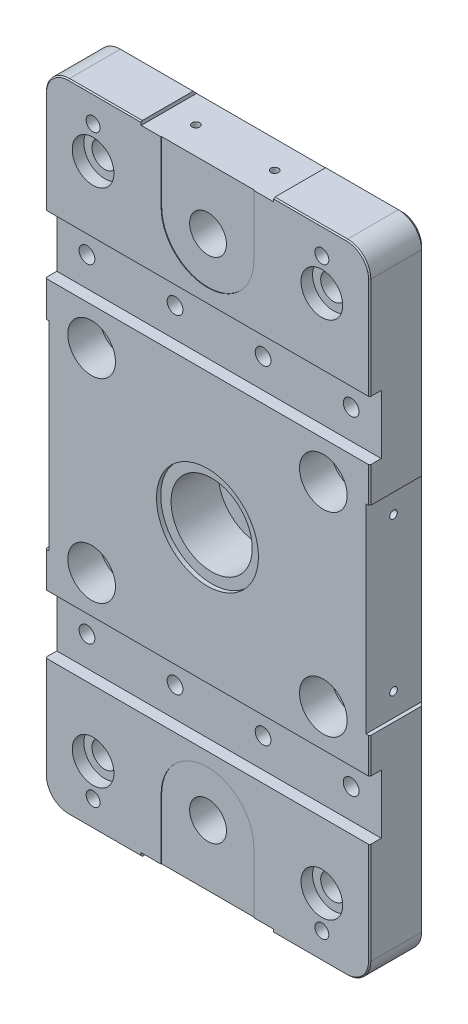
SolidWorks part; units mm, degrees
ref_plane "Front Plane" through (0, 0, 0) normal (0, 0, 1) x (1, 0, 0)
ref_plane "Top Plane" through (0, 0, 0) normal (0, 1, 0) x (1, 0, 0)
ref_plane "Right Plane" through (0, 0, 0) normal (1, 0, 0) x (0, 0, -1)
sketch "Sketch1" plane through (0, 0, 0) normal (0, 0, 1) x (1, 0, 0)
  line L1 (-60, 137.5) -> (60, 137.5)
  line L2 (-70, 127.5) -> (-70, -127.5)
  line L3 (-60, -137.5) -> (60, -137.5)
  line L4 (70, 127.5) -> (70, -127.5)
  line L5 (-70, 137.5) -> (70, -137.5) construction
  line L6 (-70, -137.5) -> (70, 137.5) construction
  arc A0 (-60, 137.5) -> (-70, 127.5) centre (-60, 127.5) ccw
  arc A1 (70, 127.5) -> (60, 137.5) centre (60, 127.5) ccw
  arc A2 (60, -137.5) -> (70, -127.5) centre (60, -127.5) ccw
  arc A3 (-70, -127.5) -> (-60, -137.5) centre (-60, -127.5) ccw
  point P0 (0, 0)
  dimension "D3" = 10
  dimension "D1" = 140
  dimension "D2" = 275
extrude "Extrude1" add sketch "Sketch1" along normal blind 23.9
sketch "Sketch6" plane through (0, 0, 0) normal (0, 0, -1) x (-1, 0, 0)
  line L0 (-49.43, 74.93) -> (-62.43, 61.93)
  line L1 (-49.43, 74.93) -> (49.43, 74.93)
  line L2 (-62.43, 61.93) -> (-62.43, -61.93)
  line L3 (-49.43, -74.93) -> (49.43, -74.93)
  line L4 (62.43, 61.93) -> (62.43, -61.93)
  line L5 (-62.43, 74.93) -> (62.43, -74.93) construction
  line L6 (-62.43, -74.93) -> (62.43, 74.93) construction
  line L7 (49.43, 74.93) -> (62.43, 61.93)
  line L8 (62.43, -61.93) -> (49.43, -74.93)
  line L9 (-62.43, -61.93) -> (-49.43, -74.93)
  point P0 (0, 0)
  dimension "D1" = 62.43
  dimension "D2" = 74.93
  dimension "D3" = 74.93
extrude "Extrude5" add sketch "Sketch6" along normal blind 6
sketch "Sketch2" plane through (0, 0, 23.9) normal (0, 0, 1) x (1, 0, 0)
  circle A0 centre (0, 0) radius 22
  dimension "D1" = 44
extrude "Extrude2" cut sketch "Sketch2" against normal blind 1.8
sketch "Sketch3" plane through (0, 0, 23.9) normal (0, 0, 1) x (1, 0, 0)
  line L0 (-85.9067, 0) -> (80.4153, 0) construction
  line L1 (-70, 127.5) -> (-70, -127.5) construction
  line L2 (-70, 83.7) -> (-70, 58.2)
  line L3 (70, -127.5) -> (70, 127.5) construction
  line L4 (70, -83.7) -> (70, -58.2)
  line L5 (-70, -58.2) -> (70, -58.2)
  line L6 (-70, 58.2) -> (70, 58.2)
  line L7 (-70, 83.7) -> (70, 83.7)
  line L8 (-70, -83.7) -> (70, -83.7)
  line L9 (-85.9067, 83.7) -> (80.4153, 83.7) construction
  line L10 (-85.9067, -83.7) -> (80.4153, -83.7) construction
  line L11 (-85.9067, 58.2) -> (80.4153, 58.2) construction
  line L12 (-85.9067, -58.2) -> (80.4153, -58.2) construction
  line L13 (70, 58.2) -> (70, 83.7)
  line L14 (-70, -58.2) -> (-70, -83.7)
  dimension "D1" = 58.2
  dimension "D2" = 58.2
  dimension "D3" = 25.5
  dimension "D4" = 25.5
extrude "Extrude3" cut sketch "Sketch3" against normal blind 5
sketch "Sketch5" plane through (0, 0, 23.9) normal (0, 0, 1) x (1, 0, 0)
  circle A0 centre (0, 0) radius 17.5125
  dimension "D1" = 35.025
extrude "Extrude4" cut sketch "Sketch5" against normal blind 22.2
sketch "Sketch7" plane through (0, 0, 23.9) normal (0, 0, 1) x (1, 0, 0)
  line L0 (0, 0) -> (78.6902, 0) construction
  circle A0 centre (0, 109.6) radius 7.95
  circle A1 centre (0, 0) radius 17.5125 construction
  circle A2 centre (0, -109.6) radius 7.95
  dimension "D1" = 15.9
  dimension "D2" = 109.6
extrude "Extrude6" cut sketch "Sketch7" against normal blind 22
sketch "Sketch9" plane through (70, 0, 0) normal (1, 0, 0) x (0, 0, -1)
  line L0 (0, 0) -> (-23.9, 0) construction
  line L2 (0, -127.5) -> (0, 127.5) construction
  line L3 (-23.9, -58.2) -> (-23.9, 58.2) construction
  line L4 (0, 43) -> (-23.9, 43)
  line L5 (0, -43) -> (-23.9, -43)
  line L6 (0, -43) -> (0, 43)
  line L7 (-23.9, -43) -> (-23.9, 43)
  dimension "D1" = 43
  dimension "D2" = 43
extrude "Cut-Extrude1" cut sketch "Sketch9" against normal blind 1.6
mirror "Mirror1" about plane through (0, 0, 0) normal (1, 0, 0) of "Cut-Extrude1"
sketch "Sketch10" plane through (0, 137.5, 0) normal (0, 1, 0) x (1, 0, 0)
  line L4 (-28.6, -26) -> (28.6, -26)
  line L11 (-28.6, -26) -> (-28.6, 2)
  line L12 (-28.6, 2) -> (28.6, 2)
  line L13 (28.6, -26) -> (28.6, 2)
  dimension "D1" = 28.6
  dimension "D2" = 28.6
  dimension "D3" = 2
  dimension "D4" = 28
extrude "Cut-Extrude2" cut sketch "Sketch10" against normal blind 1.6
mirror "Mirror2" about plane through (0, 0, 0) normal (0, 1, 0) of "Cut-Extrude2"
sketch "Sketch13" plane through (0, -135.9, 0) normal (0, -1, 0) x (1, 0, 0)
  line L0 (28.6, 23.9) -> (-28.6, 23.9) construction
  circle A0 centre (-17, 11.9) radius 1.65
  circle A1 centre (17, 11.9) radius 1.65
  dimension "D1" = 3.3
  dimension "D2" = 17
  dimension "D3" = 17
  dimension "D4" = 12
extrude "Cut-Extrude5" cut sketch "Sketch13" against normal blind 8
sketch "Sketch14" plane through (0, -127.9, 0) normal (0, -1, 0) x (1, 0, 0)
  circle A1 centre (-17, 11.9) radius 1.65
  circle A2 centre (-17, 11.9) radius 1.65
  circle A3 centre (17, 11.9) radius 1.65
  circle A4 centre (17, 11.9) radius 1.65
  dimension "D1" = 0
  dimension "D2" = 0
extrude "Cut-Extrude6" cut sketch "Sketch14" against normal through all draft 60
mirror "Mirror4" about plane through (0, 0, 0) normal (0, 1, 0) of "Cut-Extrude5", "Cut-Extrude6"
sketch "Sketch16" plane through (-68.4, 0, 0) normal (-1, 0, 0) x (0, 0, 1)
  line L0 (0, 127.5) -> (0, 43) construction
  line L1 (0, -43) -> (0, 43) construction
  line L2 (0, 0) -> (246.7651, 0) construction
  circle A0 centre (12, 33) radius 1.65
  circle A1 centre (12, -33) radius 1.65
  point P6 (0, 0)
  dimension "D1" = 3.3
  dimension "D2" = 12
  dimension "D3" = 33
extrude "Cut-Extrude8" cut sketch "Sketch16" against normal blind 8
sketch "Sketch17" plane through (-60.4, 0, 0) normal (-1, 0, 0) x (0, 0, 1)
  circle A1 centre (12, 33) radius 1.65
  circle A2 centre (12, 33) radius 1.65
  circle A3 centre (12, -33) radius 1.65
  circle A4 centre (12, -33) radius 1.65
  dimension "D1" = 0
  dimension "D2" = 0
extrude "Cut-Extrude9" cut sketch "Sketch17" against normal through all draft 60
mirror "Mirror5" about plane through (0, 0, 0) normal (1, 0, 0) of "Cut-Extrude9", "Cut-Extrude8"
sketch "Sketch20" plane through (0, 0, 0) normal (0, 0, -1) x (-1, 0, 0)
  line L0 (-49.36, -112.1) -> (59.1067, -112.1) construction
  line L1 (-49.36, 112.1) -> (55.5643, 112.1) construction
  circle A1 centre (-49.36, -112.1) radius 8.5
  circle A3 centre (49.36, -112.1) radius 8.5
  circle A5 centre (-49.36, 112.1) radius 8.5
  circle A7 centre (49.36, 112.1) radius 8.5
  dimension "D1" = 17
  dimension "D6" = 17
  dimension "D8" = 17
  dimension "D10" = 17
  dimension "D2" = 49.36
  dimension "D3" = 112.1
  dimension "D4" = 49.36
  dimension "D5" = 49.36
  dimension "D7" = 112.1
  dimension "D9" = 49.36
extrude "Cut-Extrude12" cut sketch "Sketch20" against normal blind 10.8
sketch "Sketch21" plane through (0, 0, 23.9) normal (0, 0, 1) x (1, 0, 0)
  circle A0 centre (49.36, -126.1) radius 3
  circle A1 centre (-49.36, -126.1) radius 3
  circle A2 centre (-49.36, 126.1) radius 3
  circle A3 centre (49.36, 126.1) radius 3
  dimension "D1" = 6
  dimension "D2" = 126.1
  dimension "D3" = 49.36
  dimension "D4" = 126.1
  dimension "D5" = 49.36
extrude "Cut-Extrude13" cut sketch "Sketch21" against normal blind 12
sketch "Sketch22" plane through (0, 0, 11.9) normal (0, 0, 1) x (1, 0, 0)
  circle A1 centre (49.36, -126.1) radius 3
  circle A2 centre (49.36, -126.1) radius 3
  circle A3 centre (-49.36, -126.1) radius 3
  circle A4 centre (-49.36, -126.1) radius 3
  circle A5 centre (49.36, 126.1) radius 3
  circle A6 centre (49.36, 126.1) radius 3
  circle A7 centre (-49.36, 126.1) radius 3
  circle A8 centre (-49.36, 126.1) radius 3
  dimension "D1" = 0
  dimension "D2" = 0
  dimension "D3" = 0
  dimension "D4" = 0
extrude "Cut-Extrude14" cut sketch "Sketch22" against normal through all draft 60
sketch "Sketch23" plane through (0, 0, 18.9) normal (0, 0, 1) x (1, 0, 0)
  line L0 (-57, -70.9) -> (79.5762, -70.9) construction
  line L1 (0, 0) -> (101.5861, 0) construction
  line L2 (-57, 70.9) -> (79.5762, 70.9) construction
  circle A0 centre (-57, -70.9) radius 3.4
  circle A1 centre (-19, -70.9) radius 3.4
  circle A2 centre (19, -70.9) radius 3.4
  circle A3 centre (57, -70.9) radius 3.4
  circle A4 centre (57, 70.9) radius 3.4
  circle A5 centre (19, 70.9) radius 3.4
  circle A6 centre (-19, 70.9) radius 3.4
  circle A7 centre (-57, 70.9) radius 3.4
  dimension "D1" = 6.8
  dimension "D4" = 6.8
  dimension "D7" = 6.8
  dimension "D9" = 6.8
  dimension "D2" = 57
  dimension "D3" = 70.9
  dimension "D5" = 19
  dimension "D6" = 19
  dimension "D8" = 57
extrude "Cut-Extrude15" cut sketch "Sketch23" against normal blind 12
sketch "Sketch25" plane through (0, 0, 23.9) normal (0, 0, 1) x (1, 0, 0)
  circle A0 centre (-50, 42) radius 6.75
  circle A1 centre (50, 42) radius 6.75
  circle A2 centre (50, -42) radius 6.75
  circle A3 centre (-50, -42) radius 6.75
  dimension "D1" = 13.5
  dimension "D2" = 42
  dimension "D3" = 50
  dimension "D4" = 42
  dimension "D5" = 50
extrude "Extrude8" cut sketch "Sketch25" against normal through all
sketch "Sketch26" plane through (0, 0, 23.9) normal (0, 0, 1) x (1, 0, 0)
  circle A0 centre (-50, 42) radius 10.285
  circle A1 centre (50, 42) radius 10.285
  circle A2 centre (50, -42) radius 10.285
  circle A3 centre (-50, -42) radius 10.285
  dimension "D1" = 20.57
extrude "Extrude9" cut sketch "Sketch26" against normal blind 13.72
chamfer "Chamfer1" distance 1 angle 45 8 edges at (-55.93, 68.43, -6) (-62.43, 0, -6) (-55.93, -68.43, -6) (0, -74.93, -6) (55.93, -68.43, -6) (62.43, 0, -6) (55.93, 68.43, -6) (0, 74.93, -6)
chamfer "Chamfer2" distance 1.5 angle 45 12 edges at (70, -85.25, 0) (67.0711, -134.5711, 0) (44.3, -137.5, 0) (-70, -85.25, 0) (-67.0711, -134.5711, 0) (-44.3, -137.5, 0) (-44.3, 137.5, 0) (-67.0711, 134.5711, 0) (-70, 85.25, 0) (44.3, 137.5, 0) (67.0711, 134.5711, 0) (70, 85.25, 0)
chamfer "Chamfer4" distance 0.5 angle 45 16 edges at (70, 50.6, 23.9) (44.3, 137.5, 23.9) (67.0711, 134.5711, 23.9) (70, 105.6, 23.9) (-44.3, 137.5, 23.9) (-67.0711, 134.5711, 23.9) (-70, 105.6, 23.9) (-70, 50.6, 23.9) (-70, -50.6, 23.9) (-70, -105.6, 23.9) (-67.0711, -134.5711, 23.9) (-44.3, -137.5, 23.9) (44.3, -137.5, 23.9) (67.0711, -134.5711, 23.9) (70, -105.6, 23.9) (70, -50.6, 23.9)
sketch "Sketch28" plane through (0, 0, 23.9) normal (0, 0, 1) x (1, 0, 0)
  circle A0 centre (-49.36, 112.1) radius 9
  circle A1 centre (49.36, 112.1) radius 9
  circle A2 centre (49.36, -112.1) radius 9
  circle A3 centre (-49.36, -112.1) radius 9
  dimension "D1" = 18
  dimension "D2" = 18
  dimension "D3" = 18
  dimension "D4" = 18
extrude "Extrude10" cut sketch "Sketch28" against normal blind 5
sketch "Sketch29" plane through (0, 0, 23.9) normal (0, 0, 1) x (1, 0, 0)
  circle A0 centre (-49.36, 112.1) radius 5.5
  circle A1 centre (49.36, 112.1) radius 5.5
  circle A2 centre (49.36, -112.1) radius 5.5
  circle A3 centre (-49.36, -112.1) radius 5.5
  dimension "D1" = 11
  dimension "D2" = 11
  dimension "D3" = 11
  dimension "D4" = 11
extrude "Cut-Extrude18" cut sketch "Sketch29" against normal through all
sketch "Sketch33" plane through (0, 0, 23.9) normal (0, 0, 1) x (1, 0, 0)
  line L0 (20, 109.6) -> (20, 135.9)
  line L1 (-20, 109.6) -> (-20, 135.9)
  line L2 (-28.6, 135.9) -> (28.6, 135.9) construction
  line L3 (-20, 135.9) -> (20, 135.9)
  line L4 (20, -109.6) -> (20, -135.9)
  line L5 (-20, -109.6) -> (-20, -135.9)
  line L6 (28.6, -135.9) -> (-28.6, -135.9) construction
  line L7 (20, -135.9) -> (-20, -135.9)
  arc A0 (-20, 109.6) -> (20, 109.6) centre (0, 109.6) ccw
  arc A1 (20, -109.6) -> (-20, -109.6) centre (0, -109.6) ccw
  dimension "D1" = 40
  dimension "D2" = 40
extrude "Cut-Extrude19" cut sketch "Sketch33" against normal blind 0.25
